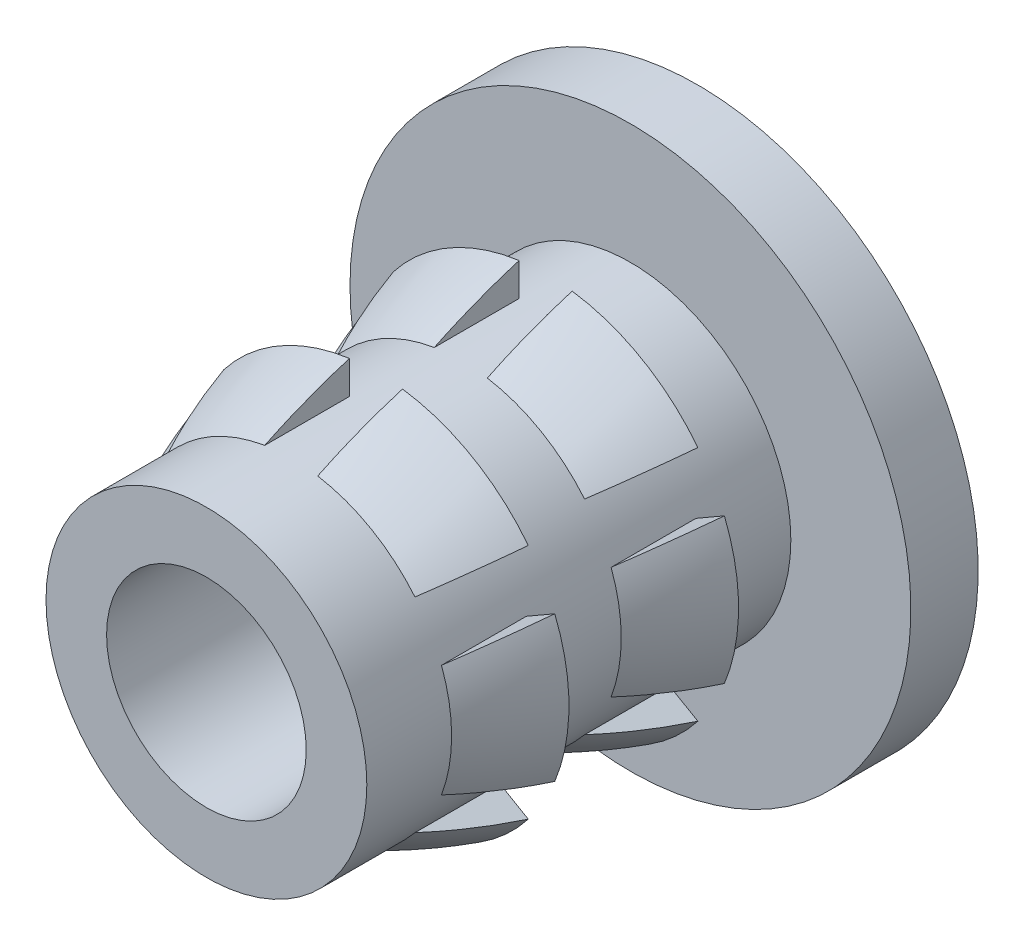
SolidWorks part; units mm, degrees
other "<flanged insert 4-40>-<CirPattern1>"
ref_plane "Front Plane" through (0, 0, 0) normal (0, 0, 1) x (1, 0, 0)
ref_plane "Top Plane" through (0, 0, 0) normal (0, 1, 0) x (1, 0, 0)
ref_plane "Right Plane" through (0, 0, 0) normal (1, 0, 0) x (0, 0, -1)
inserted part "flanged insert 4-40"
